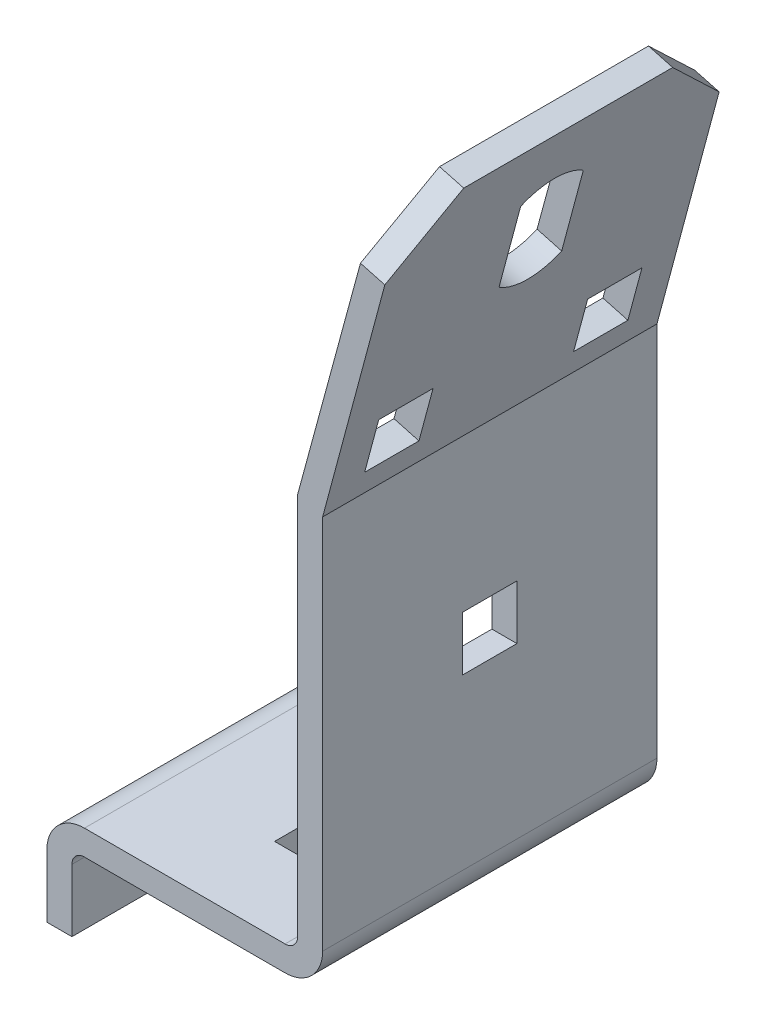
SolidWorks part; units mm, degrees
ref_plane "Front" through (0, 0, 0) normal (0, 0, 1) x (1, 0, 0)
ref_plane "Top" through (0, 0, 0) normal (0, 1, 0) x (1, 0, 0)
ref_plane "Right" through (0, 0, 0) normal (1, 0, 0) x (0, 0, -1)
sketch "Esquisse1" plane through (0, 0, 0) normal (0, 0, 1) x (1, 0, 0)
  line L0 (0, 0) -> (6, 0)
  line L1 (6, 0) -> (6, 12)
  line L2 (9, 18) -> (57, 18)
  line L3 (66, 30) -> (66, 117)
  line L4 (0, 0) -> (0, 12)
  line L5 (13.4946, 24) -> (48, 24)
  line L6 (60, 30) -> (60, 118.608)
  line L7 (66, 117) -> (84.7644, 187.0296)
  line L8 (84.7644, 187.0296) -> (78.9688, 188.5825)
  line L9 (78.9688, 188.5825) -> (60, 118.608)
  line L10 (12, 24) -> (13.4946, 24)
  line L11 (12, 24) -> (9, 24)
  line L12 (0, 15) -> (0, 12)
  line L14 (60, 30) -> (60, 27)
  line L16 (66, 30) -> (66, 27)
  line L17 (48, 24) -> (57, 24)
  line L18 (6, 15) -> (6, 12)
  arc A0 (57, 24) -> (60, 27) centre (57, 27) ccw
  arc A1 (57, 18) -> (66, 27) centre (57, 27) ccw
  arc A2 (9, 24) -> (0, 15) centre (9, 15) ccw
  arc A3 (9, 18) -> (6, 15) centre (9, 15) ccw
  point P12 (0, 24)
  point P15 (60, 18)
  point P18 (6, 18)
  point P21 (60, 24)
  dimension "D7" = 6
  dimension "D9" = 18
  dimension "D13" = 6
  dimension "D14" = 18
  dimension "Epaisseur" = 6
  dimension "D2" = 18
  dimension "D3" = 54
  dimension "hauteur de patte" = 24
  dimension "D6" = 66
  dimension "angle de pliage" = 165
  dimension "hauteur aprés plis" = 72.5
  dimension "hauteur sous plis" = 93
  dimension "D15" = 3
  dimension "D16" = 3
  dimension "D17" = 3
  dimension "D18" = 3
extrude "corps" add sketch "Esquisse1" against normal blind 80
chamfer "Chanfrein1" distance 15 angle 45 1 edges at (81.8666, 187.8061, 0)
chamfer "Chanfrein2" distance 15 angle 45 1 edges at (81.8666, 187.8061, -80)
sketch "Esquisse2" plane through (25.9412, -7.0322, 0) normal (-0.9652, 0.2616, 0) x (0, 0, 1)
  line L0 (-19.3296, 177.6747) -> (-61.0149, 177.6747) construction
  line L1 (-40, 192.6909) -> (-40, 150.4889) construction
  line L2 (0, 187.6747) -> (0, 130.1747) construction
  line L3 (-65, 202.6747) -> (-15, 202.6747) construction
  line L4 (-32.5, 187.6747) -> (-32.5, 167.6747)
  line L5 (-47.5, 187.6747) -> (-47.5, 167.6747)
  arc A0 (-47.5, 167.6747) -> (-32.5, 167.6747) centre (-40, 177.6747) ccw
  arc A1 (-32.5, 187.6747) -> (-47.5, 187.6747) centre (-40, 177.6747) ccw
  dimension "D1" = 25
  dimension "D2" = 40
  dimension "D3" = 25
  dimension "D4" = 15
  dimension "D5" = 7.5
extrude "trou oublon" cut sketch "Esquisse2" against normal blind 50
sketch "Esquisse3" plane through (25.9412, -7.0322, 0) normal (-0.9652, 0.2616, 0) x (0, 0, 1)
  line L0 (-3.8492, 142.6747) -> (-25.7253, 142.6747) construction
  line L1 (-8.5, 149.1747) -> (-21.5, 149.1747)
  line L2 (-8.5, 149.1747) -> (-8.5, 136.1747)
  line L3 (-8.5, 136.1747) -> (-21.5, 136.1747)
  line L4 (-21.5, 149.1747) -> (-21.5, 136.1747)
  line L5 (-58.5, 149.1747) -> (-71.5, 149.1747)
  line L6 (-58.5, 149.1747) -> (-58.5, 136.1747)
  line L7 (-58.5, 136.1747) -> (-71.5, 136.1747)
  line L8 (-71.5, 149.1747) -> (-71.5, 136.1747)
  line L9 (-54.1937, 142.6747) -> (-72.4525, 142.6747) construction
  line L10 (-15, 153.5894) -> (-15, 135.3306) construction
  line L11 (-65, 153.5894) -> (-65, 135.3306) construction
  line L12 (-80, 187.6747) -> (-80, 130.1747) construction
  line L13 (-65, 202.6747) -> (-15, 202.6747) construction
  dimension "D1" = 13
  dimension "D2" = 13
  dimension "D3" = 6.5
  dimension "D4" = 13
  dimension "D5" = 13
  dimension "D6" = 6.5
  dimension "D7" = 6.5
  dimension "D8" = 6.5
  dimension "D9" = 50
  dimension "D10" = 15
  dimension "D11" = 60
  dimension "D12" = 60
extrude "trou de fixation" cut sketch "Esquisse3" against normal blind 50
sketch "Esquisse4" plane through (60, 0, 0) normal (-1, 0, 0) x (0, 0, 1)
  line L0 (-27.0588, 74) -> (-51.078, 74) construction
  line L1 (-33.5, 80.5) -> (-46.5, 80.5)
  line L2 (-33.5, 80.5) -> (-33.5, 67.5)
  line L3 (-33.5, 67.5) -> (-46.5, 67.5)
  line L4 (-46.5, 80.5) -> (-46.5, 67.5)
  line L5 (-40, 85.9203) -> (-40, 63.1673) construction
  line L6 (-80, 24) -> (0, 24) construction
  line L8 (0, 118.608) -> (0, 27) construction
  dimension "D1" = 13
  dimension "D2" = 13
  dimension "D3" = 6.5
  dimension "D4" = 6.5
  dimension "D5" = 50
  dimension "D6" = 40
extrude "trou de fixation des renforts" cut sketch "Esquisse4" against normal blind 10
sketch "Esquisse5" plane through (0, 24, 0) normal (0, 1, 0) x (-1, 0, 0)
  line L0 (-41, -63.6483) -> (-41, -10.1375) construction
  line L1 (-47.5, -60) -> (-34.5, -60)
  line L2 (-47.5, -60) -> (-47.5, -20)
  line L3 (-47.5, -20) -> (-34.5, -20)
  line L4 (-34.5, -60) -> (-34.5, -20)
  line L5 (-41.022, -40) -> (-19.3588, -40) construction
  line L6 (-57, 0) -> (-9, 0) construction
  line L8 (0, -80) -> (0, 0) construction
  dimension "D1" = 40
  dimension "D2" = 13
  dimension "D3" = 40
  dimension "D4" = 20
  dimension "D5" = 6.5
  dimension "D6" = 41
extrude "trou de fixation sur chassis" cut sketch "Esquisse5" against normal blind 10
